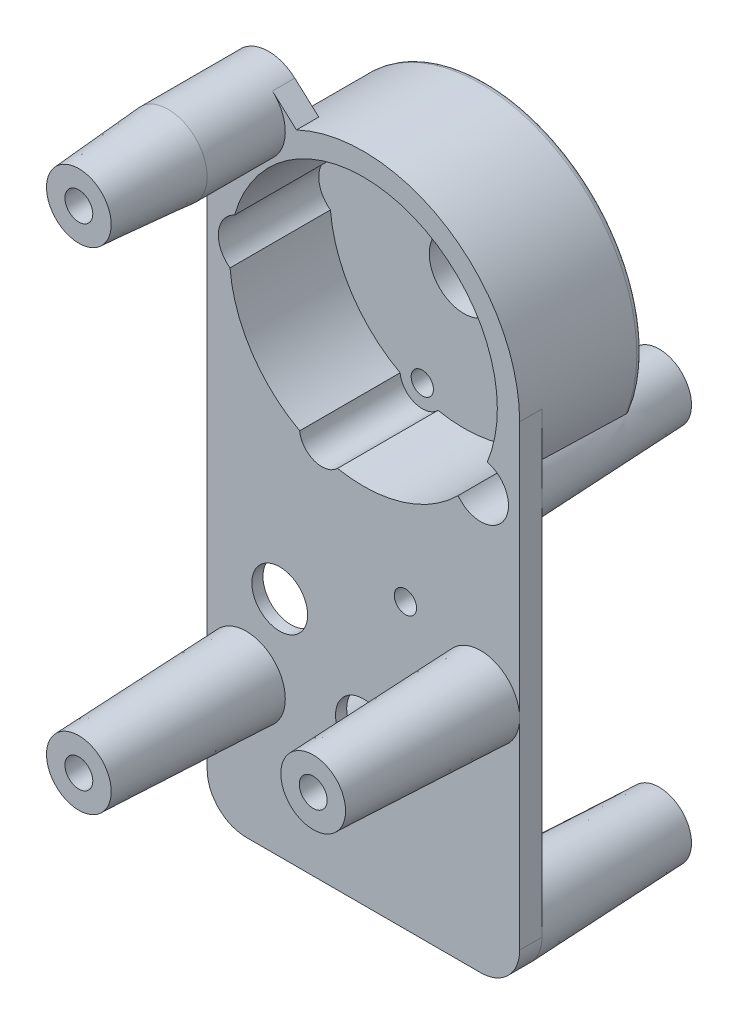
SolidWorks part; units mm, degrees
ref_plane "正面" through (0, 0, 0) normal (0, 0, 1) x (1, 0, 0)
ref_plane "平面" through (0, 0, 0) normal (0, 1, 0) x (1, 0, 0)
ref_plane "右側面" through (0, 0, 0) normal (1, 0, 0) x (0, 0, -1)
sketch "ｽｹｯﾁ1" plane through (0, 0, 0) normal (0, 0, 1) x (1, 0, 0)
  line L0 (-8.1522, 45.5957) -> (-6, 43.6491)
  line L2 (-14, 43) -> (-14, -10)
  line L3 (-10.5, -13.5) -> (10.5, -13.5)
  line L4 (14, 31) -> (14, -10)
  arc A0 (14, 31) -> (-6, 43.6491) centre (0, 31) ccw
  arc A1 (-14, -10) -> (-10.5, -13.5) centre (-10.5, -10) ccw
  arc A2 (14, -10) -> (10.5, -13.5) centre (10.5, -10) cw
  arc A4 (-8.1522, 45.5957) -> (-14, 43) centre (-10.5, 43) ccw
  dimension "D1" = 28
  dimension "D5" = 3.5
  dimension "D7" = 3.5
  dimension "D2" = 31
  dimension "D3" = 43
  dimension "D4" = 13.5
  dimension "D6" = 6
extrude "押し出し1" add sketch "ｽｹｯﾁ1" along normal blind 2
sketch "ｽｹｯﾁ3" plane through (0, 0, 2) normal (0, 0, 1) x (1, 0, 0)
  line L0 (14, -10) -> (14, 31) construction
  line L1 (-14, 43) -> (-14, -10) construction
  circle A0 centre (10.5, 8) radius 3.5
  circle A1 centre (-10.5, -1) radius 3.5
  dimension "D2" = 7
  dimension "D4" = 7
  dimension "D1" = 8
  dimension "D3" = 1
extrude "押し出し2" add sketch "ｽｹｯﾁ3" along normal blind 15 draft 2.29
sketch "ｽｹｯﾁ4" plane through (0, 0, 2) normal (0, 0, 1) x (1, 0, 0)
  circle A0 centre (-10.5, 43) radius 3.5
  arc A1 (-8.1522, 45.5957) -> (-14, 43) centre (-10.5, 43) ccw construction
extrude "押し出し3" add sketch "ｽｹｯﾁ4" along normal blind 7
sketch "ｽｹｯﾁ5" plane through (0, 0, 9) normal (0, 0, 1) x (1, 0, 0)
  circle A0 centre (-10.5, 43) radius 3.5 construction
  circle A1 centre (-10.5, 43) radius 3.5
extrude "押し出し4" add sketch "ｽｹｯﾁ5" along normal blind 8 draft 4.29
sketch "ｽｹｯﾁ6" plane through (0, 0, 0) normal (0, 0, -1) x (-1, 0, 0)
  line L0 (-14, -10) -> (-14, 31) construction
  line L1 (14, 43) -> (14, -10) construction
  circle A0 centre (10.5, 32) radius 3.5
  circle A1 centre (10.5, -10) radius 3.5
  circle A2 centre (-10.5, -10) radius 3.5
  circle A3 centre (-10.5, 24) radius 3.5
  arc A4 (10.5, -13.5) -> (14, -10) centre (10.5, -10) ccw construction
  arc A5 (-14, -10) -> (-10.5, -13.5) centre (-10.5, -10) ccw construction
  dimension "D1" = 7
  dimension "D2" = 7
  dimension "D3" = 24
  dimension "D4" = 32
extrude "押し出し5" add sketch "ｽｹｯﾁ6" along normal blind 14 draft 2.45
hole_wizard "M3x0.5 ねじ穴1" positions "ｽｹｯﾁ8" profile "ｽｹｯﾁ7" tap size "M3x0.5" standard "JIS"
sketch "ｽｹｯﾁ8" plane through (0, 0, 17) normal (0, 0, 1) x (1, 0, 0)
  point P0 (-10.5, 43)
  point P1 (-10.5, -1)
  point P4 (10.5, 8)
sketch "ｽｹｯﾁ7" plane through (-10.5, 43, 17) normal (1, 0, 0) x (0, -1, 0)
  line L0 (0, 0) -> (0, 9.2511)
  line L1 (0, 9.2511) -> (1.25, 8.5)
  line L2 (1.25, 8.5) -> (1.25, 0)
  line L5 (1.25, 0) -> (0, 0)
  line L10 (0, 9.2511) -> (-1.25, 8.5) construction
  line L11 (0, -6.35) -> (0, 107.95) construction
  dimension "ねじ下穴ﾄﾞﾘﾙの直径" = 2.5
  dimension "ねじ下穴ﾄﾞﾘﾙの深さ" = 8.5
  dimension "ﾄﾞﾘﾙ角度" = 118
hole_wizard "M3x0.5 ねじ穴2" positions "ｽｹｯﾁ10" profile "ｽｹｯﾁ9" tap size "M3x0.5" standard "JIS"
sketch "ｽｹｯﾁ10" plane through (0, 0, -14) normal (0, 0, -1) x (-1, 0, 0)
  point P0 (10.5, 32)
  point P1 (-10.5, 24)
  point P4 (-10.5, -10)
  point P7 (10.5, -10)
sketch "ｽｹｯﾁ9" plane through (-10.5, 32, -14) normal (1, 0, 0) x (0, 1, 0)
  line L0 (0, 0) -> (0, 9.2511)
  line L1 (0, 9.2511) -> (1.25, 8.5)
  line L2 (1.25, 8.5) -> (1.25, 0)
  line L5 (1.25, 0) -> (0, 0)
  line L10 (0, 9.2511) -> (-1.25, 8.5) construction
  line L11 (0, -6.35) -> (0, 107.95) construction
  dimension "ねじ下穴ﾄﾞﾘﾙの直径" = 2.5
  dimension "ねじ下穴ﾄﾞﾘﾙの深さ" = 8.5
  dimension "ﾄﾞﾘﾙ角度" = 118
sketch "ｽｹｯﾁ11" plane through (0, 0, 2) normal (0, 0, 1) x (1, 0, 0)
  circle A0 centre (0, 31) radius 14
  arc A1 (14, 31) -> (-6, 43.6491) centre (0, 31) ccw construction
extrude "押し出し6" add sketch "ｽｹｯﾁ11" against normal blind 11
sketch "ｽｹｯﾁ12" plane through (0, 0, 2) normal (0, 0, 1) x (1, 0, 0)
  circle A0 centre (0, 31) radius 12
  arc A1 (14, 31) -> (-6, 43.6491) centre (0, 31) ccw construction
  dimension "D1" = 24
extrude "ｶｯﾄ - 押し出し1" cut sketch "ｽｹｯﾁ12" against normal blind 9
sketch "ｽｹｯﾁ13" plane through (0, 0, 0) normal (0, 0, -1) x (-1, 0, 0)
  circle A0 centre (0, 0) radius 12.5 construction
  circle A1 centre (7.5, 6.5) radius 12.5 construction
  circle A2 centre (-3.7639, 11.9199) radius 11.5 construction
  circle A3 centre (0, 31) radius 11 construction
  dimension "D1" = 25
  dimension "D2" = 25
  dimension "D3" = 23
  dimension "D4" = 22
  dimension "D5" = 7.5
  dimension "D6" = 6.5
sketch "ｽｹｯﾁ15" plane through (0, 0, 0) normal (0, 0, -1) x (-1, 0, 0)
  circle A0 centre (-3.7639, 11.9199) radius 3
  dimension "D1" = 6
extrude "押し出し7" add sketch "ｽｹｯﾁ15" along normal blind 5.3 draft 5.4
sketch "ｽｹｯﾁ17" plane through (0, 0, 2) normal (0, 0, 1) x (1, 0, 0)
  circle A0 centre (-10.5, 32) radius 2.5
  circle A1 centre (-3.7228, 20.6491) radius 2
  circle A2 centre (3.7639, 11.9199) radius 11.5 construction
  circle A3 centre (0, 31) radius 11 construction
  circle A4 centre (10.5, 24) radius 2.5
  dimension "D1" = 5
  dimension "D2" = 4
  dimension "D3" = 5
extrude "ｶｯﾄ - 押し出し2" cut sketch "ｽｹｯﾁ17" against normal blind 9
sketch "ｽｹｯﾁ18" plane through (0, 0, 2) normal (0, 0, 1) x (1, 0, 0)
  circle A0 centre (0, 31) radius 3.1
  circle A1 centre (3.7639, 11.9199) radius 1
  circle A2 centre (-3.7228, 20.6491) radius 1
  circle A3 centre (3.7639, 11.9199) radius 11.5 construction
  circle A4 centre (0, 31) radius 11 construction
  circle A5 centre (-7.5, 6.5) radius 2.5
  circle A6 centre (0, 0) radius 2.5
  dimension "D1" = 6.2
  dimension "D2" = 2
  dimension "D3" = 2
  dimension "D4" = 5
  dimension "D5" = 5
extrude "ｶｯﾄ - 押し出し3" cut sketch "ｽｹｯﾁ18" against normal through all
sketch "ｽｹｯﾁ19" plane through (0, 0, 0) normal (0, 0, -1) x (-1, 0, 0)
  circle A0 centre (7.5, 6.5) radius 4.5
  circle A1 centre (0, 0) radius 4.5
  dimension "D1" = 9
  dimension "D2" = 9
extrude "ｶｯﾄ - 押し出し4" cut sketch "ｽｹｯﾁ19" against normal blind 1
fillet "ﾌｨﾚｯﾄ1" radius 0.5 1 edges at (-11.6487, 38.7658, -9)
